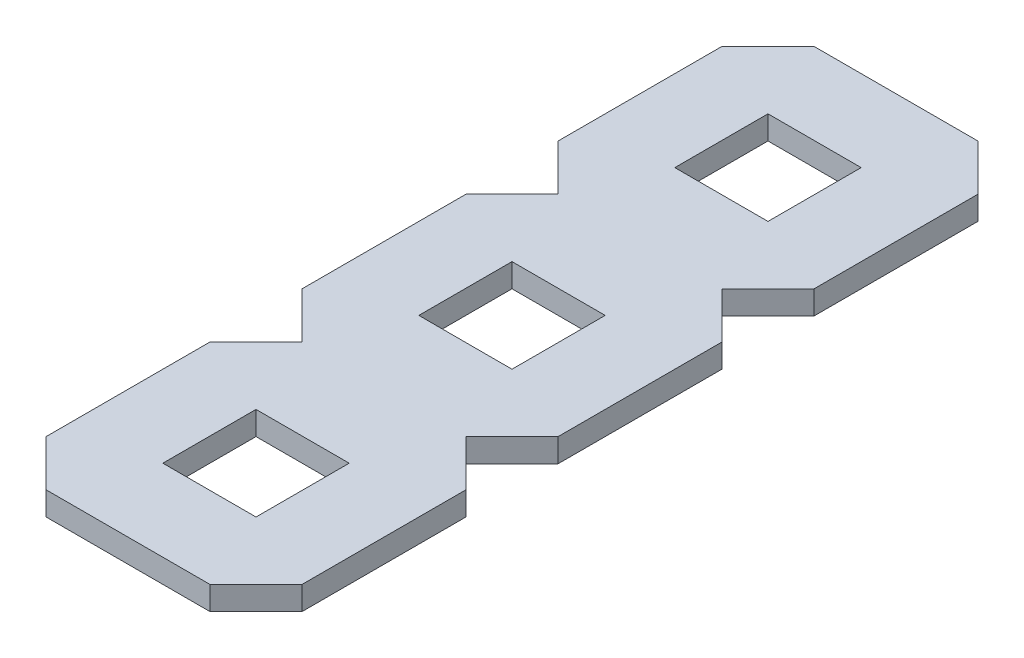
SolidWorks part; units mm, degrees
ref_plane "Front" through (0, 0, 0) normal (0, 0, 1) x (1, 0, 0)
ref_plane "Top" through (0, 0, 0) normal (0, 1, 0) x (1, 0, 0)
ref_plane "Right" through (0, 0, 0) normal (1, 0, 0) x (0, 0, -1)
ref_plane "Plane1" through (0, 1.1684, 0) normal (0, 1, 0) x (1, 0, 0)
sketch "Sketch1" plane through (0, 1.1684, 0) normal (0, 1, 0) x (1, 0, 0)
  line L0 (14.981, 127) -> (12.7, 124.719)
  line L1 (12.7, 124.719) -> (10.419, 127)
  line L2 (10.419, 127) -> (2.281, 127)
  line L3 (2.281, 127) -> (0, 124.719)
  line L4 (0, 124.719) -> (0, 116.581)
  line L5 (0, 116.581) -> (2.281, 114.3)
  line L6 (2.281, 114.3) -> (0, 112.019)
  line L7 (0, 112.019) -> (0, 103.881)
  line L8 (0, 103.881) -> (2.281, 101.6)
  line L9 (2.281, 101.6) -> (0, 99.319)
  line L10 (0, 99.319) -> (0, 91.181)
  line L11 (0, 91.181) -> (2.281, 88.9)
  line L12 (2.281, 88.9) -> (0, 86.619)
  line L13 (0, 86.619) -> (0, 78.481)
  line L14 (0, 78.481) -> (2.281, 76.2)
  line L15 (2.281, 76.2) -> (0, 73.919)
  line L16 (0, 73.919) -> (0, 65.781)
  line L17 (0, 65.781) -> (2.281, 63.5)
  line L18 (2.281, 63.5) -> (0, 61.219)
  line L19 (0, 61.219) -> (0, 53.081)
  line L20 (0, 53.081) -> (2.281, 50.8)
  line L21 (2.281, 50.8) -> (0, 48.519)
  line L22 (0, 48.519) -> (0, 40.381)
  line L23 (0, 40.381) -> (2.281, 38.1)
  line L24 (2.281, 38.1) -> (0, 35.819)
  line L25 (0, 35.819) -> (0, 27.681)
  line L26 (0, 27.681) -> (2.281, 25.4)
  line L27 (2.281, 25.4) -> (0, 23.119)
  line L28 (0, 23.119) -> (0, 14.981)
  line L29 (0, 14.981) -> (2.281, 12.7)
  line L30 (2.281, 12.7) -> (0, 10.419)
  line L31 (0, 10.419) -> (0, 2.281)
  line L32 (0, 2.281) -> (2.281, 0)
  line L33 (2.281, 0) -> (10.419, 0)
  line L34 (10.419, 0) -> (12.7, 2.281)
  line L35 (12.7, 2.281) -> (14.981, 0)
  line L36 (14.981, 0) -> (23.119, 0)
  line L37 (23.119, 0) -> (25.4, 2.281)
  line L38 (25.4, 2.281) -> (27.681, 0)
  line L39 (27.681, 0) -> (35.819, 0)
  line L40 (35.819, 0) -> (38.1, 2.281)
  line L41 (38.1, 2.281) -> (40.381, 0)
  line L42 (40.381, 0) -> (48.519, 0)
  line L43 (48.519, 0) -> (50.8, 2.281)
  line L44 (50.8, 2.281) -> (53.081, 0)
  line L45 (53.081, 0) -> (61.219, 0)
  line L46 (61.219, 0) -> (63.5, 2.281)
  line L47 (63.5, 2.281) -> (63.5, 10.419)
  line L48 (63.5, 10.419) -> (61.219, 12.7)
  line L49 (61.219, 12.7) -> (63.5, 14.981)
  line L50 (63.5, 14.981) -> (63.5, 23.119)
  line L51 (63.5, 23.119) -> (61.219, 25.4)
  line L52 (61.219, 25.4) -> (63.5, 27.681)
  line L53 (63.5, 27.681) -> (63.5, 35.819)
  line L54 (63.5, 35.819) -> (61.219, 38.1)
  line L55 (61.219, 38.1) -> (63.5, 40.381)
  line L56 (63.5, 40.381) -> (63.5, 48.519)
  line L57 (63.5, 48.519) -> (61.219, 50.8)
  line L58 (61.219, 50.8) -> (63.5, 53.081)
  line L59 (63.5, 53.081) -> (63.5, 61.219)
  line L60 (63.5, 61.219) -> (61.219, 63.5)
  line L61 (61.219, 63.5) -> (63.5, 65.781)
  line L62 (63.5, 65.781) -> (63.5, 73.919)
  line L63 (63.5, 73.919) -> (61.219, 76.2)
  line L64 (61.219, 76.2) -> (63.5, 78.481)
  line L65 (63.5, 78.481) -> (63.5, 86.619)
  line L66 (63.5, 86.619) -> (61.219, 88.9)
  line L67 (61.219, 88.9) -> (63.5, 91.181)
  line L68 (63.5, 91.181) -> (63.5, 99.319)
  line L69 (63.5, 99.319) -> (61.219, 101.6)
  line L70 (61.219, 101.6) -> (63.5, 103.881)
  line L71 (63.5, 103.881) -> (63.5, 112.019)
  line L72 (63.5, 112.019) -> (61.219, 114.3)
  line L73 (61.219, 114.3) -> (63.5, 116.581)
  line L74 (63.5, 116.581) -> (63.5, 124.719)
  line L75 (63.5, 124.719) -> (61.219, 127)
  line L76 (61.219, 127) -> (53.081, 127)
  line L77 (53.081, 127) -> (50.8, 124.719)
  line L78 (50.8, 124.719) -> (48.519, 127)
  line L79 (48.519, 127) -> (40.381, 127)
  line L80 (40.381, 127) -> (38.1, 124.719)
  line L81 (38.1, 124.719) -> (35.819, 127)
  line L82 (35.819, 127) -> (27.681, 127)
  line L83 (27.681, 127) -> (25.4, 124.719)
  line L84 (25.4, 124.719) -> (23.119, 127)
  line L85 (23.119, 127) -> (14.981, 127)
  line L86 (12.7, 112.019) -> (10.419, 114.3)
  line L87 (10.419, 114.3) -> (12.7, 116.581)
  line L88 (12.7, 116.581) -> (14.981, 114.3)
  line L89 (14.981, 114.3) -> (12.7, 112.019)
  line L90 (12.7, 86.619) -> (10.419, 88.9)
  line L91 (10.419, 88.9) -> (12.7, 91.181)
  line L92 (12.7, 91.181) -> (14.981, 88.9)
  line L93 (14.981, 88.9) -> (12.7, 86.619)
  line L94 (12.7, 61.219) -> (10.419, 63.5)
  line L95 (10.419, 63.5) -> (12.7, 65.781)
  line L96 (12.7, 65.781) -> (14.981, 63.5)
  line L97 (14.981, 63.5) -> (12.7, 61.219)
  line L98 (12.7, 35.819) -> (10.419, 38.1)
  line L99 (10.419, 38.1) -> (12.7, 40.381)
  line L100 (12.7, 40.381) -> (14.981, 38.1)
  line L101 (14.981, 38.1) -> (12.7, 35.819)
  line L102 (12.7, 10.419) -> (10.419, 12.7)
  line L103 (10.419, 12.7) -> (12.7, 14.981)
  line L104 (12.7, 14.981) -> (14.981, 12.7)
  line L105 (14.981, 12.7) -> (12.7, 10.419)
  line L106 (25.4, 112.019) -> (23.119, 114.3)
  line L107 (23.119, 114.3) -> (25.4, 116.581)
  line L108 (25.4, 116.581) -> (27.681, 114.3)
  line L109 (27.681, 114.3) -> (25.4, 112.019)
  line L110 (25.4, 86.619) -> (23.119, 88.9)
  line L111 (23.119, 88.9) -> (25.4, 91.181)
  line L112 (25.4, 91.181) -> (27.681, 88.9)
  line L113 (27.681, 88.9) -> (25.4, 86.619)
  line L114 (25.4, 61.219) -> (23.119, 63.5)
  line L115 (23.119, 63.5) -> (25.4, 65.781)
  line L116 (25.4, 65.781) -> (27.681, 63.5)
  line L117 (27.681, 63.5) -> (25.4, 61.219)
  line L118 (25.4, 35.819) -> (23.119, 38.1)
  line L119 (23.119, 38.1) -> (25.4, 40.381)
  line L120 (25.4, 40.381) -> (27.681, 38.1)
  line L121 (27.681, 38.1) -> (25.4, 35.819)
  line L122 (25.4, 10.419) -> (23.119, 12.7)
  line L123 (23.119, 12.7) -> (25.4, 14.981)
  line L124 (25.4, 14.981) -> (27.681, 12.7)
  line L125 (27.681, 12.7) -> (25.4, 10.419)
  line L126 (38.1, 112.019) -> (35.819, 114.3)
  line L127 (35.819, 114.3) -> (38.1, 116.581)
  line L128 (38.1, 116.581) -> (40.381, 114.3)
  line L129 (40.381, 114.3) -> (38.1, 112.019)
  line L130 (38.1, 86.619) -> (35.819, 88.9)
  line L131 (35.819, 88.9) -> (38.1, 91.181)
  line L132 (38.1, 91.181) -> (40.381, 88.9)
  line L133 (40.381, 88.9) -> (38.1, 86.619)
  line L134 (38.1, 61.219) -> (35.819, 63.5)
  line L135 (35.819, 63.5) -> (38.1, 65.781)
  line L136 (38.1, 65.781) -> (40.381, 63.5)
  line L137 (40.381, 63.5) -> (38.1, 61.219)
  line L138 (38.1, 35.819) -> (35.819, 38.1)
  line L139 (35.819, 38.1) -> (38.1, 40.381)
  line L140 (38.1, 40.381) -> (40.381, 38.1)
  line L141 (40.381, 38.1) -> (38.1, 35.819)
  line L142 (38.1, 10.419) -> (35.819, 12.7)
  line L143 (35.819, 12.7) -> (38.1, 14.981)
  line L144 (38.1, 14.981) -> (40.381, 12.7)
  line L145 (40.381, 12.7) -> (38.1, 10.419)
  line L146 (50.8, 112.019) -> (48.519, 114.3)
  line L147 (48.519, 114.3) -> (50.8, 116.581)
  line L148 (50.8, 116.581) -> (53.081, 114.3)
  line L149 (53.081, 114.3) -> (50.8, 112.019)
  line L150 (50.8, 86.619) -> (48.519, 88.9)
  line L151 (48.519, 88.9) -> (50.8, 91.181)
  line L152 (50.8, 91.181) -> (53.081, 88.9)
  line L153 (53.081, 88.9) -> (50.8, 86.619)
  line L154 (50.8, 61.219) -> (48.519, 63.5)
  line L155 (48.519, 63.5) -> (50.8, 65.781)
  line L156 (50.8, 65.781) -> (53.081, 63.5)
  line L157 (53.081, 63.5) -> (50.8, 61.219)
  line L158 (50.8, 35.819) -> (48.519, 38.1)
  line L159 (48.519, 38.1) -> (50.8, 40.381)
  line L160 (50.8, 40.381) -> (53.081, 38.1)
  line L161 (53.081, 38.1) -> (50.8, 35.819)
  line L162 (50.8, 10.419) -> (48.519, 12.7)
  line L163 (48.519, 12.7) -> (50.8, 14.981)
  line L164 (50.8, 14.981) -> (53.081, 12.7)
  line L165 (53.081, 12.7) -> (50.8, 10.419)
  line L166 (8.6614, 122.9614) -> (8.6614, 118.3386)
  line L167 (8.6614, 118.3386) -> (4.0386, 118.3386)
  line L168 (4.0386, 118.3386) -> (4.0386, 122.9614)
  line L169 (4.0386, 122.9614) -> (8.6614, 122.9614)
  line L170 (21.3614, 122.9614) -> (21.3614, 118.3386)
  line L171 (21.3614, 118.3386) -> (16.7386, 118.3386)
  line L172 (16.7386, 118.3386) -> (16.7386, 122.9614)
  line L173 (16.7386, 122.9614) -> (21.3614, 122.9614)
  line L174 (34.0614, 122.9614) -> (34.0614, 118.3386)
  line L175 (34.0614, 118.3386) -> (29.4386, 118.3386)
  line L176 (29.4386, 118.3386) -> (29.4386, 122.9614)
  line L177 (29.4386, 122.9614) -> (34.0614, 122.9614)
  line L178 (46.7614, 122.9614) -> (46.7614, 118.3386)
  line L179 (46.7614, 118.3386) -> (42.1386, 118.3386)
  line L180 (42.1386, 118.3386) -> (42.1386, 122.9614)
  line L181 (42.1386, 122.9614) -> (46.7614, 122.9614)
  line L182 (59.4614, 122.9614) -> (59.4614, 118.3386)
  line L183 (59.4614, 118.3386) -> (54.8386, 118.3386)
  line L184 (54.8386, 118.3386) -> (54.8386, 122.9614)
  line L185 (54.8386, 122.9614) -> (59.4614, 122.9614)
  line L186 (8.6614, 110.2614) -> (8.6614, 105.6386)
  line L187 (8.6614, 105.6386) -> (4.0386, 105.6386)
  line L188 (4.0386, 105.6386) -> (4.0386, 110.2614)
  line L189 (4.0386, 110.2614) -> (8.6614, 110.2614)
  line L190 (59.4614, 110.2614) -> (59.4614, 105.6386)
  line L191 (59.4614, 105.6386) -> (54.8386, 105.6386)
  line L192 (54.8386, 105.6386) -> (54.8386, 110.2614)
  line L193 (54.8386, 110.2614) -> (59.4614, 110.2614)
  line L194 (8.6614, 97.5614) -> (8.6614, 92.9386)
  line L195 (8.6614, 92.9386) -> (4.0386, 92.9386)
  line L196 (4.0386, 92.9386) -> (4.0386, 97.5614)
  line L197 (4.0386, 97.5614) -> (8.6614, 97.5614)
  line L198 (59.4614, 97.5614) -> (59.4614, 92.9386)
  line L199 (59.4614, 92.9386) -> (54.8386, 92.9386)
  line L200 (54.8386, 92.9386) -> (54.8386, 97.5614)
  line L201 (54.8386, 97.5614) -> (59.4614, 97.5614)
  line L202 (8.6614, 84.8614) -> (8.6614, 80.2386)
  line L203 (8.6614, 80.2386) -> (4.0386, 80.2386)
  line L204 (4.0386, 80.2386) -> (4.0386, 84.8614)
  line L205 (4.0386, 84.8614) -> (8.6614, 84.8614)
  line L206 (59.4614, 84.8614) -> (59.4614, 80.2386)
  line L207 (59.4614, 80.2386) -> (54.8386, 80.2386)
  line L208 (54.8386, 80.2386) -> (54.8386, 84.8614)
  line L209 (54.8386, 84.8614) -> (59.4614, 84.8614)
  line L210 (8.6614, 72.1614) -> (8.6614, 67.5386)
  line L211 (8.6614, 67.5386) -> (4.0386, 67.5386)
  line L212 (4.0386, 67.5386) -> (4.0386, 72.1614)
  line L213 (4.0386, 72.1614) -> (8.6614, 72.1614)
  line L214 (59.4614, 72.1614) -> (59.4614, 67.5386)
  line L215 (59.4614, 67.5386) -> (54.8386, 67.5386)
  line L216 (54.8386, 67.5386) -> (54.8386, 72.1614)
  line L217 (54.8386, 72.1614) -> (59.4614, 72.1614)
  line L218 (8.6614, 59.4614) -> (8.6614, 54.8386)
  line L219 (8.6614, 54.8386) -> (4.0386, 54.8386)
  line L220 (4.0386, 54.8386) -> (4.0386, 59.4614)
  line L221 (4.0386, 59.4614) -> (8.6614, 59.4614)
  line L222 (59.4614, 59.4614) -> (59.4614, 54.8386)
  line L223 (59.4614, 54.8386) -> (54.8386, 54.8386)
  line L224 (54.8386, 54.8386) -> (54.8386, 59.4614)
  line L225 (54.8386, 59.4614) -> (59.4614, 59.4614)
  line L226 (8.6614, 46.7614) -> (8.6614, 42.1386)
  line L227 (8.6614, 42.1386) -> (4.0386, 42.1386)
  line L228 (4.0386, 42.1386) -> (4.0386, 46.7614)
  line L229 (4.0386, 46.7614) -> (8.6614, 46.7614)
  line L230 (59.4614, 46.7614) -> (59.4614, 42.1386)
  line L231 (59.4614, 42.1386) -> (54.8386, 42.1386)
  line L232 (54.8386, 42.1386) -> (54.8386, 46.7614)
  line L233 (54.8386, 46.7614) -> (59.4614, 46.7614)
  line L234 (8.6614, 34.0614) -> (8.6614, 29.4386)
  line L235 (8.6614, 29.4386) -> (4.0386, 29.4386)
  line L236 (4.0386, 29.4386) -> (4.0386, 34.0614)
  line L237 (4.0386, 34.0614) -> (8.6614, 34.0614)
  line L238 (59.4614, 34.0614) -> (59.4614, 29.4386)
  line L239 (59.4614, 29.4386) -> (54.8386, 29.4386)
  line L240 (54.8386, 29.4386) -> (54.8386, 34.0614)
  line L241 (54.8386, 34.0614) -> (59.4614, 34.0614)
  line L242 (8.6614, 21.3614) -> (8.6614, 16.7386)
  line L243 (8.6614, 16.7386) -> (4.0386, 16.7386)
  line L244 (4.0386, 16.7386) -> (4.0386, 21.3614)
  line L245 (4.0386, 21.3614) -> (8.6614, 21.3614)
  line L246 (59.4614, 21.3614) -> (59.4614, 16.7386)
  line L247 (59.4614, 16.7386) -> (54.8386, 16.7386)
  line L248 (54.8386, 16.7386) -> (54.8386, 21.3614)
  line L249 (54.8386, 21.3614) -> (59.4614, 21.3614)
  line L250 (8.6614, 8.6614) -> (8.6614, 4.0386)
  line L251 (8.6614, 4.0386) -> (4.0386, 4.0386)
  line L252 (4.0386, 4.0386) -> (4.0386, 8.6614)
  line L253 (4.0386, 8.6614) -> (8.6614, 8.6614)
  line L254 (21.3614, 8.6614) -> (21.3614, 4.0386)
  line L255 (21.3614, 4.0386) -> (16.7386, 4.0386)
  line L256 (16.7386, 4.0386) -> (16.7386, 8.6614)
  line L257 (16.7386, 8.6614) -> (21.3614, 8.6614)
  line L258 (34.0614, 8.6614) -> (34.0614, 4.0386)
  line L259 (34.0614, 4.0386) -> (29.4386, 4.0386)
  line L260 (29.4386, 4.0386) -> (29.4386, 8.6614)
  line L261 (29.4386, 8.6614) -> (34.0614, 8.6614)
  line L262 (21.3614, 110.2614) -> (21.3614, 105.6386)
  line L263 (21.3614, 105.6386) -> (16.7386, 105.6386)
  line L264 (16.7386, 105.6386) -> (16.7386, 110.2614)
  line L265 (16.7386, 110.2614) -> (21.3614, 110.2614)
  line L266 (34.0614, 110.2614) -> (34.0614, 105.6386)
  line L267 (34.0614, 105.6386) -> (29.4386, 105.6386)
  line L268 (29.4386, 105.6386) -> (29.4386, 110.2614)
  line L269 (29.4386, 110.2614) -> (34.0614, 110.2614)
  line L270 (46.7614, 110.2614) -> (46.7614, 105.6386)
  line L271 (46.7614, 105.6386) -> (42.1386, 105.6386)
  line L272 (42.1386, 105.6386) -> (42.1386, 110.2614)
  line L273 (42.1386, 110.2614) -> (46.7614, 110.2614)
  line L274 (21.3614, 97.5614) -> (21.3614, 92.9386)
  line L275 (21.3614, 92.9386) -> (16.7386, 92.9386)
  line L276 (16.7386, 92.9386) -> (16.7386, 97.5614)
  line L277 (16.7386, 97.5614) -> (21.3614, 97.5614)
  line L278 (34.0614, 97.5614) -> (34.0614, 92.9386)
  line L279 (34.0614, 92.9386) -> (29.4386, 92.9386)
  line L280 (29.4386, 92.9386) -> (29.4386, 97.5614)
  line L281 (29.4386, 97.5614) -> (34.0614, 97.5614)
  line L282 (46.7614, 97.5614) -> (46.7614, 92.9386)
  line L283 (46.7614, 92.9386) -> (42.1386, 92.9386)
  line L284 (42.1386, 92.9386) -> (42.1386, 97.5614)
  line L285 (42.1386, 97.5614) -> (46.7614, 97.5614)
  line L286 (21.3614, 84.8614) -> (21.3614, 80.2386)
  line L287 (21.3614, 80.2386) -> (16.7386, 80.2386)
  line L288 (16.7386, 80.2386) -> (16.7386, 84.8614)
  line L289 (16.7386, 84.8614) -> (21.3614, 84.8614)
  line L290 (34.0614, 84.8614) -> (34.0614, 80.2386)
  line L291 (34.0614, 80.2386) -> (29.4386, 80.2386)
  line L292 (29.4386, 80.2386) -> (29.4386, 84.8614)
  line L293 (29.4386, 84.8614) -> (34.0614, 84.8614)
  line L294 (46.7614, 84.8614) -> (46.7614, 80.2386)
  line L295 (46.7614, 80.2386) -> (42.1386, 80.2386)
  line L296 (42.1386, 80.2386) -> (42.1386, 84.8614)
  line L297 (42.1386, 84.8614) -> (46.7614, 84.8614)
  line L298 (21.3614, 72.1614) -> (21.3614, 67.5386)
  line L299 (21.3614, 67.5386) -> (16.7386, 67.5386)
  line L300 (16.7386, 67.5386) -> (16.7386, 72.1614)
  line L301 (16.7386, 72.1614) -> (21.3614, 72.1614)
  line L302 (34.0614, 72.1614) -> (34.0614, 67.5386)
  line L303 (34.0614, 67.5386) -> (29.4386, 67.5386)
  line L304 (29.4386, 67.5386) -> (29.4386, 72.1614)
  line L305 (29.4386, 72.1614) -> (34.0614, 72.1614)
  line L306 (46.7614, 72.1614) -> (46.7614, 67.5386)
  line L307 (46.7614, 67.5386) -> (42.1386, 67.5386)
  line L308 (42.1386, 67.5386) -> (42.1386, 72.1614)
  line L309 (42.1386, 72.1614) -> (46.7614, 72.1614)
  line L310 (21.3614, 59.4614) -> (21.3614, 54.8386)
  line L311 (21.3614, 54.8386) -> (16.7386, 54.8386)
  line L312 (16.7386, 54.8386) -> (16.7386, 59.4614)
  line L313 (16.7386, 59.4614) -> (21.3614, 59.4614)
  line L314 (34.0614, 59.4614) -> (34.0614, 54.8386)
  line L315 (34.0614, 54.8386) -> (29.4386, 54.8386)
  line L316 (29.4386, 54.8386) -> (29.4386, 59.4614)
  line L317 (29.4386, 59.4614) -> (34.0614, 59.4614)
  line L318 (46.7614, 59.4614) -> (46.7614, 54.8386)
  line L319 (46.7614, 54.8386) -> (42.1386, 54.8386)
  line L320 (42.1386, 54.8386) -> (42.1386, 59.4614)
  line L321 (42.1386, 59.4614) -> (46.7614, 59.4614)
  line L322 (21.3614, 46.7614) -> (21.3614, 42.1386)
  line L323 (21.3614, 42.1386) -> (16.7386, 42.1386)
  line L324 (16.7386, 42.1386) -> (16.7386, 46.7614)
  line L325 (16.7386, 46.7614) -> (21.3614, 46.7614)
  line L326 (34.0614, 46.7614) -> (34.0614, 42.1386)
  line L327 (34.0614, 42.1386) -> (29.4386, 42.1386)
  line L328 (29.4386, 42.1386) -> (29.4386, 46.7614)
  line L329 (29.4386, 46.7614) -> (34.0614, 46.7614)
  line L330 (46.7614, 46.7614) -> (46.7614, 42.1386)
  line L331 (46.7614, 42.1386) -> (42.1386, 42.1386)
  line L332 (42.1386, 42.1386) -> (42.1386, 46.7614)
  line L333 (42.1386, 46.7614) -> (46.7614, 46.7614)
  line L334 (21.3614, 34.0614) -> (21.3614, 29.4386)
  line L335 (21.3614, 29.4386) -> (16.7386, 29.4386)
  line L336 (16.7386, 29.4386) -> (16.7386, 34.0614)
  line L337 (16.7386, 34.0614) -> (21.3614, 34.0614)
  line L338 (34.0614, 34.0614) -> (34.0614, 29.4386)
  line L339 (34.0614, 29.4386) -> (29.4386, 29.4386)
  line L340 (29.4386, 29.4386) -> (29.4386, 34.0614)
  line L341 (29.4386, 34.0614) -> (34.0614, 34.0614)
  line L342 (46.7614, 34.0614) -> (46.7614, 29.4386)
  line L343 (46.7614, 29.4386) -> (42.1386, 29.4386)
  line L344 (42.1386, 29.4386) -> (42.1386, 34.0614)
  line L345 (42.1386, 34.0614) -> (46.7614, 34.0614)
  line L346 (21.3614, 21.3614) -> (21.3614, 16.7386)
  line L347 (21.3614, 16.7386) -> (16.7386, 16.7386)
  line L348 (16.7386, 16.7386) -> (16.7386, 21.3614)
  line L349 (16.7386, 21.3614) -> (21.3614, 21.3614)
  line L350 (34.0614, 21.3614) -> (34.0614, 16.7386)
  line L351 (34.0614, 16.7386) -> (29.4386, 16.7386)
  line L352 (29.4386, 16.7386) -> (29.4386, 21.3614)
  line L353 (29.4386, 21.3614) -> (34.0614, 21.3614)
  line L354 (59.4614, 8.6614) -> (59.4614, 4.0386)
  line L355 (59.4614, 4.0386) -> (54.8386, 4.0386)
  line L356 (54.8386, 4.0386) -> (54.8386, 8.6614)
  line L357 (54.8386, 8.6614) -> (59.4614, 8.6614)
  line L358 (46.7614, 21.3614) -> (46.7614, 16.7386)
  line L359 (46.7614, 16.7386) -> (42.1386, 16.7386)
  line L360 (42.1386, 16.7386) -> (42.1386, 21.3614)
  line L361 (42.1386, 21.3614) -> (46.7614, 21.3614)
  line L362 (46.7614, 8.6614) -> (46.7614, 4.0386)
  line L363 (46.7614, 4.0386) -> (42.1386, 4.0386)
  line L364 (42.1386, 4.0386) -> (42.1386, 8.6614)
  line L365 (42.1386, 8.6614) -> (46.7614, 8.6614)
  line L366 (50.8, 23.119) -> (48.519, 25.4)
  line L367 (48.519, 25.4) -> (50.8, 27.681)
  line L368 (50.8, 27.681) -> (53.081, 25.4)
  line L369 (53.081, 25.4) -> (50.8, 23.119)
  line L370 (50.8, 48.519) -> (48.519, 50.8)
  line L371 (48.519, 50.8) -> (50.8, 53.081)
  line L372 (50.8, 53.081) -> (53.081, 50.8)
  line L373 (53.081, 50.8) -> (50.8, 48.519)
  line L374 (50.8, 73.919) -> (48.519, 76.2)
  line L375 (48.519, 76.2) -> (50.8, 78.481)
  line L376 (50.8, 78.481) -> (53.081, 76.2)
  line L377 (53.081, 76.2) -> (50.8, 73.919)
  line L378 (50.8, 99.319) -> (48.519, 101.6)
  line L379 (48.519, 101.6) -> (50.8, 103.881)
  line L380 (50.8, 103.881) -> (53.081, 101.6)
  line L381 (53.081, 101.6) -> (50.8, 99.319)
  line L382 (38.1, 23.119) -> (35.819, 25.4)
  line L383 (35.819, 25.4) -> (38.1, 27.681)
  line L384 (38.1, 27.681) -> (40.381, 25.4)
  line L385 (40.381, 25.4) -> (38.1, 23.119)
  line L386 (38.1, 48.519) -> (35.819, 50.8)
  line L387 (35.819, 50.8) -> (38.1, 53.081)
  line L388 (38.1, 53.081) -> (40.381, 50.8)
  line L389 (40.381, 50.8) -> (38.1, 48.519)
  line L390 (38.1, 73.919) -> (35.819, 76.2)
  line L391 (35.819, 76.2) -> (38.1, 78.481)
  line L392 (38.1, 78.481) -> (40.381, 76.2)
  line L393 (40.381, 76.2) -> (38.1, 73.919)
  line L394 (38.1, 99.319) -> (35.819, 101.6)
  line L395 (35.819, 101.6) -> (38.1, 103.881)
  line L396 (38.1, 103.881) -> (40.381, 101.6)
  line L397 (40.381, 101.6) -> (38.1, 99.319)
  line L398 (25.4, 23.119) -> (23.119, 25.4)
  line L399 (23.119, 25.4) -> (25.4, 27.681)
  line L400 (25.4, 27.681) -> (27.681, 25.4)
  line L401 (27.681, 25.4) -> (25.4, 23.119)
  line L402 (25.4, 48.519) -> (23.119, 50.8)
  line L403 (23.119, 50.8) -> (25.4, 53.081)
  line L404 (25.4, 53.081) -> (27.681, 50.8)
  line L405 (27.681, 50.8) -> (25.4, 48.519)
  line L406 (25.4, 73.919) -> (23.119, 76.2)
  line L407 (23.119, 76.2) -> (25.4, 78.481)
  line L408 (25.4, 78.481) -> (27.681, 76.2)
  line L409 (27.681, 76.2) -> (25.4, 73.919)
  line L410 (25.4, 99.319) -> (23.119, 101.6)
  line L411 (23.119, 101.6) -> (25.4, 103.881)
  line L412 (25.4, 103.881) -> (27.681, 101.6)
  line L413 (27.681, 101.6) -> (25.4, 99.319)
  line L414 (12.7, 23.119) -> (10.419, 25.4)
  line L415 (10.419, 25.4) -> (12.7, 27.681)
  line L416 (12.7, 27.681) -> (14.981, 25.4)
  line L417 (14.981, 25.4) -> (12.7, 23.119)
  line L418 (12.7, 48.519) -> (10.419, 50.8)
  line L419 (10.419, 50.8) -> (12.7, 53.081)
  line L420 (12.7, 53.081) -> (14.981, 50.8)
  line L421 (14.981, 50.8) -> (12.7, 48.519)
  line L422 (12.7, 73.919) -> (10.419, 76.2)
  line L423 (10.419, 76.2) -> (12.7, 78.481)
  line L424 (12.7, 78.481) -> (14.981, 76.2)
  line L425 (14.981, 76.2) -> (12.7, 73.919)
  line L426 (12.7, 99.319) -> (10.419, 101.6)
  line L427 (10.419, 101.6) -> (12.7, 103.881)
  line L428 (12.7, 103.881) -> (14.981, 101.6)
  line L429 (14.981, 101.6) -> (12.7, 99.319)
extrude "Boss-Extrude1" add sketch "Sketch1" against normal blind 1.1684
sketch "Sketch2" plane through (0, 1.1684, 0) normal (0, 1, 0) x (1, 0, 0)
  line L1 (63.5, 127) -> (0, 127)
  line L2 (63.5, 127) -> (63.5, 63.5)
  line L3 (63.5, 63.5) -> (0, 63.5)
  line L4 (0, 127) -> (0, 63.5)
extrude "Cut-Extrude1" cut sketch "Sketch2" against normal blind 2.54
sketch "Sketch3" plane through (0, 1.1684, 0) normal (0, 1, 0) x (1, 0, 0)
  line L1 (12.7, 65.781) -> (69.7181, 65.781)
  line L2 (12.7, 65.781) -> (12.7, 25.4)
  line L3 (12.7, -2.023) -> (69.7181, -2.023)
  line L4 (69.7181, 65.781) -> (69.7181, -2.023)
  line L5 (-3.9299, 25.4) -> (12.7, 25.4)
  line L6 (-3.9299, 25.4) -> (-3.9299, -2.023)
  line L7 (-3.9299, -2.023) -> (12.7, -2.023)
extrude "Cut-Extrude2" cut sketch "Sketch3" against normal blind 13.97
